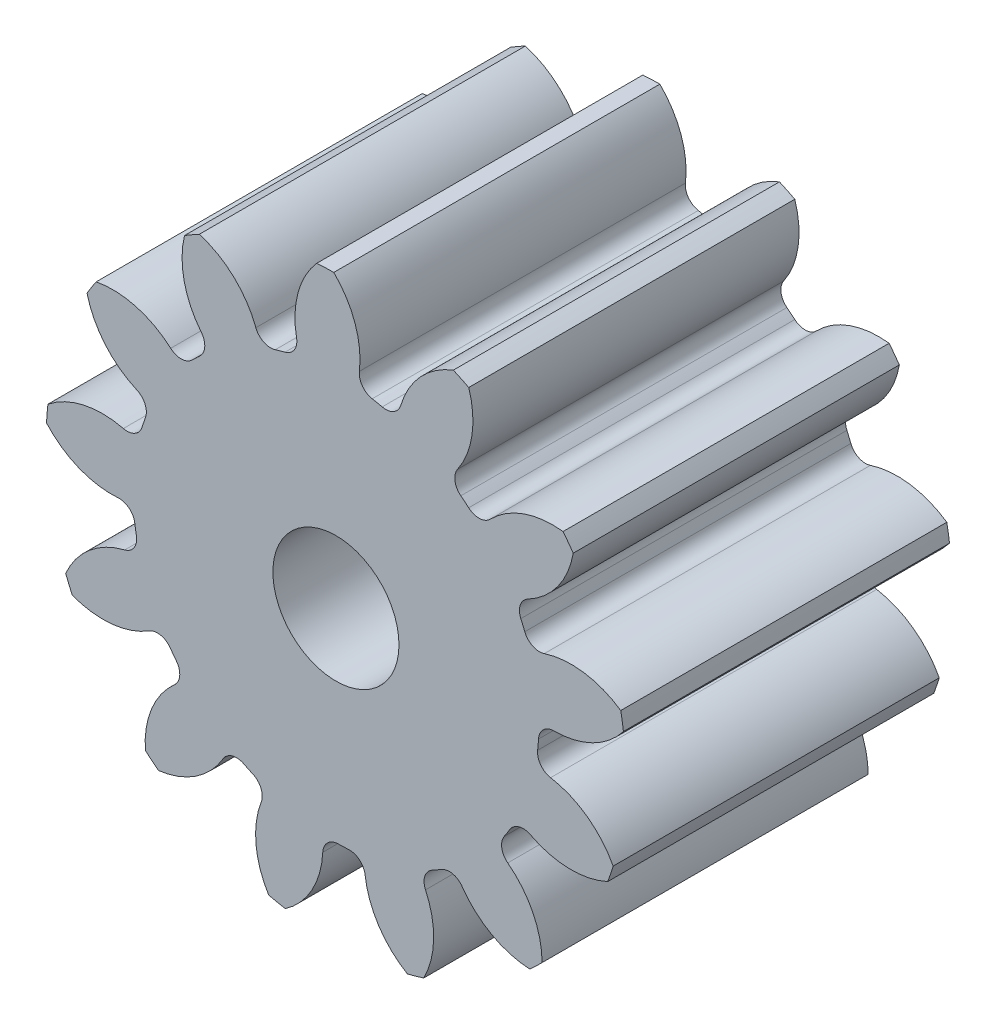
SolidWorks part; units mm, degrees
ref_plane "Front" through (0, 0, 0) normal (0, 0, 1) x (1, 0, 0)
ref_plane "Top" through (0, 0, 0) normal (0, 1, 0) x (1, 0, 0)
ref_plane "Right" through (0, 0, 0) normal (1, 0, 0) x (0, 0, -1)
sketch "Sketch3" plane through (0, 0, 0) normal (0, 0, 1) x (1, 0, 0)
  circle A0 centre (0, 0) radius 84.6667
  dimension "od" = 169.3333
extrude "gearBody" add sketch "Sketch3" along normal blind 95.25
sketch "Sketch2" plane through (0, 0, 0) normal (0, 0, 1) x (1, 0, 0)
  line L0 (0, 0) -> (63.7039, 26.387) construction
  line L1 (81.505, -25.7709) -> (0, 0) construction
  line L2 (0, 0) -> (36.3143, 0) construction
  line L3 (73.3274, 2.7185) -> (71.8405, -14.9412) construction
  line L5 (72.584, -6.1114) -> (0, 0) construction
  line L7 (0, 0) -> (68.9526, 0) construction
  arc A0 (68.9388, 1.3789) -> (67.7377, -12.8866) centre (0, 0) ccw construction
  arc A1 (83.9713, 10.8293) -> (80.9783, -24.7175) centre (0, 0) ccw construction
  arc A2 (73.3274, 2.7185) -> (71.8405, -14.9412) centre (0, 0) ccw construction
  arc A3 (58.9142, -6.4545) -> (59.164, -3.4874) centre (0, 0) ccw
  arc A4 (81.505, -25.7709) -> (62.7061, -11.4836) centre (58.3949, -36.6674) ccw
  arc A5 (81.505, -25.7709) -> (84.6667, 11.7798) centre (0, 0) ccw
  arc A6 (84.6667, 11.7798) -> (63.7435, 0.8369) centre (63.7039, 26.387) cw
  arc A7 (59.164, -3.4874) -> (63.7435, 0.8369) centre (63.7506, -3.7577) cw
  arc A8 (62.7061, -11.4836) -> (58.9142, -6.4545) centre (63.4814, -6.9549) cw
  point P6 (84.6667, 11.7798)
  point P22 (81.505, -25.7709)
  dimension "baseDia" = 137.9051
  dimension "od" = 169.3333
  dimension "pd" = 146.7556
  dimension "rd" = 118.5333
  dimension "rFillet" = 4.5946
  dimension "pointX" = 84.6667
  dimension "pointY" = 11.7798
  dimension "CTT" = 17.6597
  dimension "flankCenterAngle" = 22.5
extrude "toothCut" cut sketch "Sketch2" along normal through all
pattern_circular "CirPattern1" count 13 over 360 about axis through (0, 0, 0) along (0, 0, 1) of "toothCut"
sketch "hub1Dia" plane through (0, 0, 0) normal (0, 0, -1) x (-1, 0, 0)
  circle A0 centre (0, 0) radius 12.7
  dimension "hub1Dia" = 25.4
sketch "hub2Dia" plane through (0, 0, 95.25) normal (0, 0, 1) x (1, 0, 0)
  circle A0 centre (0, 0) radius 12.7
  dimension "hub2dia" = 25.4
sketch "boreDia" plane through (0, 0, 0) normal (0, 0, 1) x (1, 0, 0)
  circle A0 centre (0, 0) radius 18.415
  dimension "boreDia" = 36.83
extrude "bore" cut sketch "boreDia" against normal mid plane 25400
